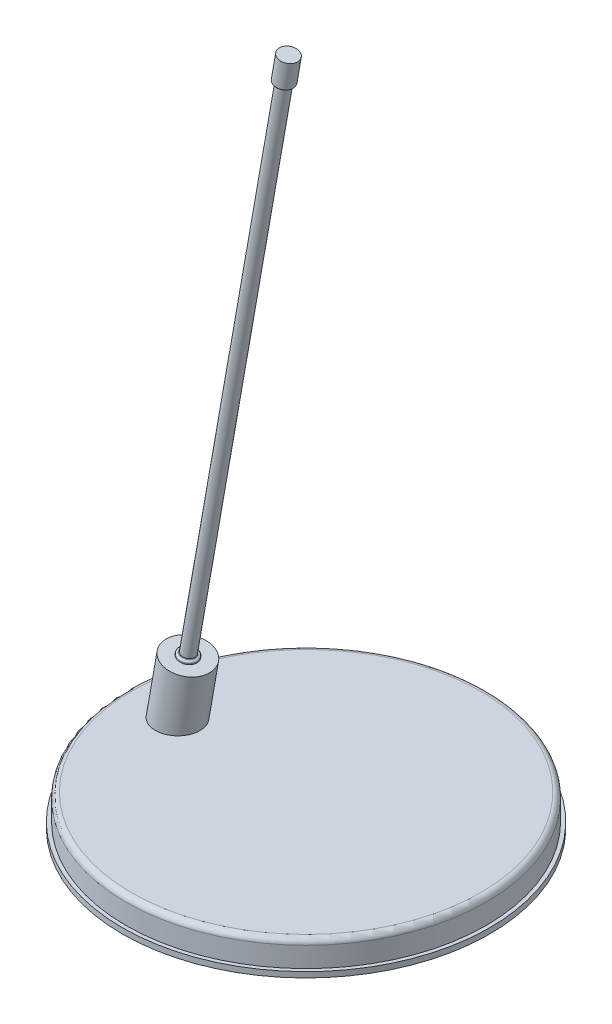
SolidWorks part; units mm, degrees
ref_plane "Front Plane" through (0, 0, 0) normal (0, 0, 1) x (1, 0, 0)
ref_plane "Top Plane" through (0, 0, 0) normal (0, 1, 0) x (1, 0, 0)
ref_plane "Right Plane" through (0, 0, 0) normal (1, 0, 0) x (0, 0, -1)
sketch "Sketch1" plane through (0, 0, 0) normal (0, 1, 0) x (1, 0, 0)
  circle A0 centre (0, 0) radius 50
  dimension "D1" = 100
extrude "Boss-Extrude1" add sketch "Sketch1" along normal blind 1.5
sketch "Sketch2" plane through (0, 1.5, 0) normal (0, 1, 0) x (1, 0, 0)
  circle A0 centre (0, 0) radius 49
  dimension "D1" = 98
extrude "Boss-Extrude2" add sketch "Sketch2" along normal blind 7 separate body
fillet "Fillet1" radius 1.5 1 edges at (0, 8.5, 49)
sketch "Sketch3" plane through (0, 0, 0) normal (0, 0, 1) x (1, 0, 0)
  line L0 (-35, 8.5) -> (-32.1788, 24.5) construction
  line L1 (47.5, 8.5) -> (-47.5, 8.5) construction
  point P4 (-32.0334, 25.3242)
  dimension "D1" = 80
  dimension "D2" = 15
  dimension "D3" = 16
ref_plane "Plane1" through (-32.1788, 24.5, 0) normal (0.1736, 0.9848, 0) x (0.9848, -0.1736, 0)
sketch "Sketch4" plane through (-32.1788, 24.5, 0) normal (0.1736, 0.9848, 0) x (0.9848, -0.1736, 0)
  circle A0 centre (0, 0) radius 6
  dimension "D1" = 12
extrude "Boss-Extrude3" add sketch "Sketch4" along direction (0.1736, 0.9848, 0) on the side against the normal up to surface (17.3048 mm away)
sketch "Sketch5" plane through (3.2194, 18.2583, 0) normal (0.1736, 0.9848, 0) x (0.9848, -0.1736, 0)
  circle A0 centre (-35.9443, 0) radius 2.5
  circle A1 centre (-35.9443, 0) radius 6 construction
  dimension "D1" = 5
extrude "Boss-Extrude4" add sketch "Sketch5" along direction (0.1736, 0.9848, 0) on the side of the normal blind 0.8
fillet "Fillet2" radius 0.5 1 edges at (-34.5019, 25.722, 0)
sketch "Sketch6" plane through (3.3584, 19.0462, 0) normal (0.1736, 0.9848, 0) x (0.9848, -0.1736, 0)
  circle A0 centre (-35.9443, 0) radius 1.75
  dimension "D1" = 3.5
extrude "Boss-Extrude5" add sketch "Sketch6" along normal blind 150
sketch "Sketch7" plane through (29.4056, 166.7674, 0) normal (0.1736, 0.9848, 0) x (0.9848, -0.1736, 0)
  circle A0 centre (-35.9443, 0) radius 2.5
  dimension "D1" = 5
extrude "Boss-Extrude6" add sketch "Sketch7" along normal blind 7
fillet "Fillet3" radius 0.1 1 edges at (-33.7633, 25.5917, 0)
fillet "Fillet4" radius 0.1 1 edges at (-8.4546, 173.4431, 0)
